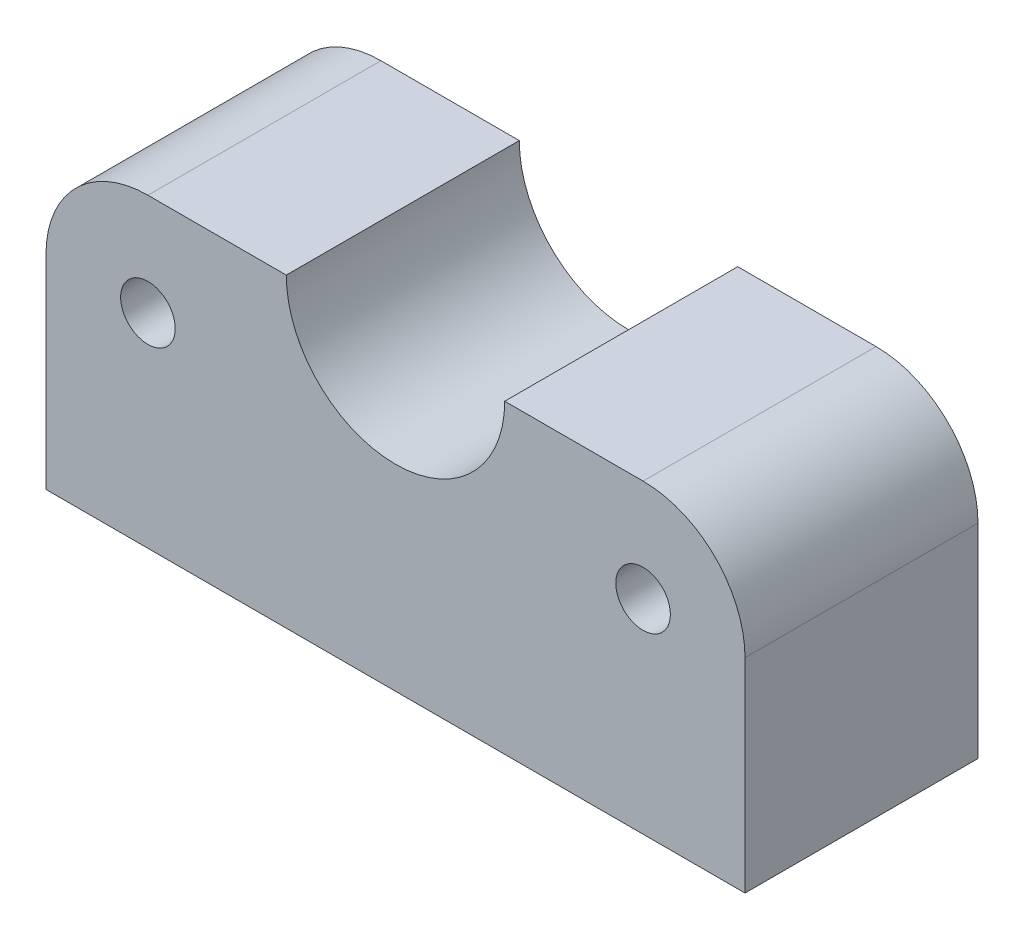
SolidWorks part; units mm, degrees
ref_plane "Front" through (0, 0, 0) normal (0, 0, 1) x (1, 0, 0)
ref_plane "Top" through (0, 0, 0) normal (0, 1, 0) x (1, 0, 0)
ref_plane "Right" through (0, 0, 0) normal (1, 0, 0) x (0, 0, -1)
sketch "Sketch3" plane through (0, 0, 0) normal (0, 0, 1) x (1, 0, 0)
  line L10 (-101.6, 29.6333) -> (-101.6, 0)
  line L11 (-66.675, 44.45) -> (-86.7833, 44.45)
  line L12 (-14.8167, 44.45) -> (-34.925, 44.45)
  line L13 (0, 0) -> (0, 29.6333)
  line L14 (-101.6, 0) -> (0, 0)
  arc A6 (-86.7833, 44.45) -> (-101.6, 29.6333) centre (-86.7833, 29.6333) ccw
  arc A7 (-66.675, 44.45) -> (-34.925, 44.45) centre (-50.8, 44.45) ccw
  arc A8 (0, 29.6333) -> (-14.8167, 44.45) centre (-14.8167, 29.6333) ccw
  dimension "D3" = 15.875
  dimension "D4" = 14.8167
  dimension "D1" = 101.6
  dimension "D2" = 44.45
extrude "Base-Extrude" add sketch "Sketch3" against normal blind 33.8667
hole_wizard "3/8-16 Tapped Hole1" positions "Sketch5" profile "Sketch4" tap size "3/8-16" standard "Ansi Inch"
sketch "Sketch5" plane through (0, 0, 0) normal (0, 0, 1) x (1, 0, 0)
  arc A0 (-86.7833, 44.45) -> (-101.6, 29.6333) centre (-86.7833, 29.6333) ccw construction
  point P0 (-86.7833, 29.6333)
  point P1 (-14.8167, 29.6333)
sketch "Sketch4" plane through (-86.7833, 29.6333, 0) normal (1, 0, 0) x (0, -1, 0)
  line L0 (0, 0) -> (0, 26.1972)
  line L1 (0, 26.1972) -> (3.9687, 23.8125)
  line L2 (3.9687, 23.8125) -> (3.9687, 0)
  line L5 (3.9687, 0) -> (0, 0)
  line L10 (0, 26.1972) -> (-3.9688, 23.8125) construction
  line L11 (0, -6.35) -> (0, 107.95) construction
  dimension "Hole Dia." = 7.9375
  dimension "Hole Depth" = 23.8125
  dimension "Drill Angle" = 118
